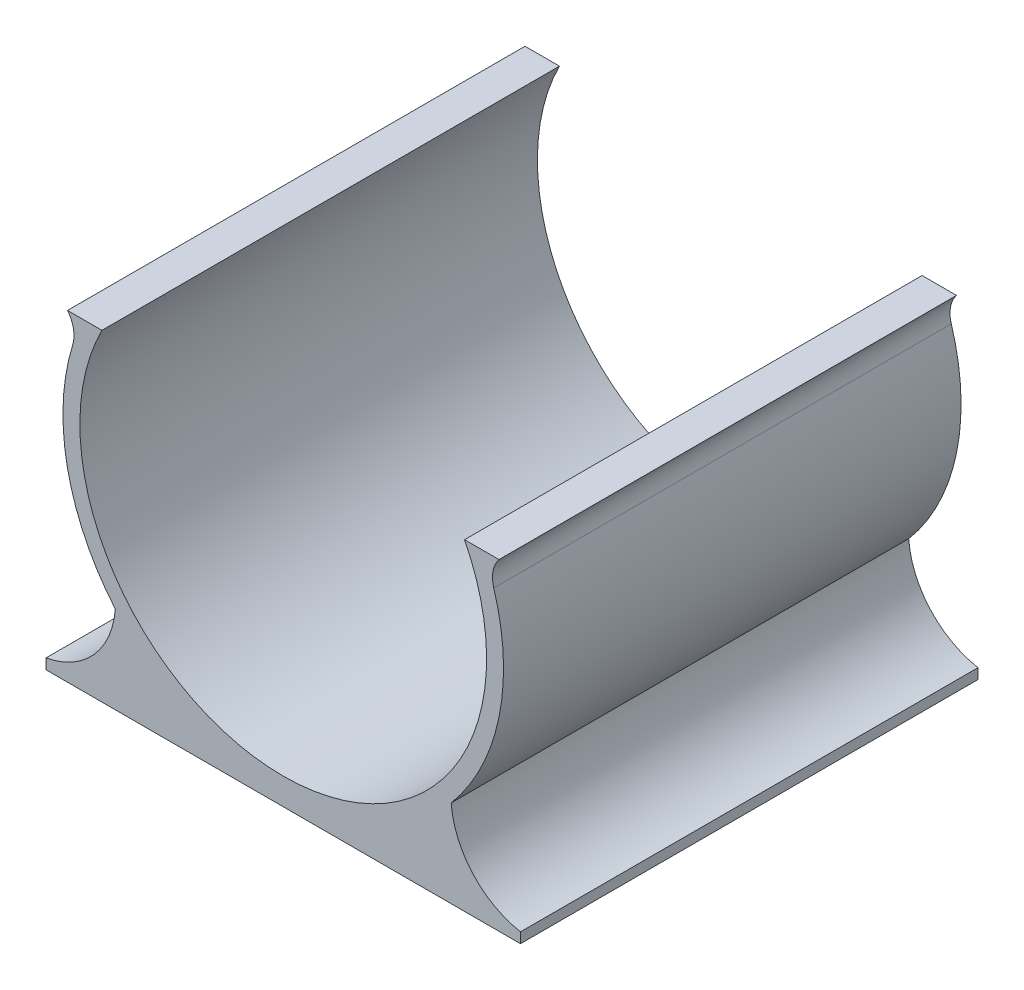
SolidWorks part; units mm, degrees
ref_plane "Front Plane" through (0, 0, 0) normal (0, 0, 1) x (1, 0, 0)
ref_plane "Top Plane" through (0, 0, 0) normal (0, 1, 0) x (1, 0, 0)
ref_plane "Right Plane" through (0, 0, 0) normal (1, 0, 0) x (0, 0, -1)
ref_plane "Plane1" through (0, -14, 0) normal (0, -1, 0) x (1, 0, 0)
sketch "Sketch1" plane through (0, -14, 0) normal (0, -1, 0) x (1, 0, 0)
  line L0 (-13, 0) -> (15, 0)
  line L1 (15, 0) -> (15, 27)
  line L2 (15, 27) -> (-13, 27)
  line L3 (-13, 27) -> (-13, 0)
  dimension "D1" = 28
  dimension "D2" = 27
extrude "Extrude1" add sketch "Sketch1" against normal blind 19
sketch "Sketch2" plane through (0, 0, 0) normal (0, 0, -1) x (-1, 0, 0)
  line L0 (-14.5994, 5.5776) -> (-15.8957, 5.5776)
  line L1 (-15.8957, 5.5776) -> (-15.8957, -13.4726)
  line L2 (-15, -14) -> (13, -14) construction
  line L3 (-1, -14) -> (-1, 7.3227) construction
  line L4 (12.5994, 5.5776) -> (13.8957, 5.5776)
  line L5 (13.8957, 5.5776) -> (13.8957, -13.4726)
  arc A0 (-10.9098, -8.8476) -> (-13.4237, 3.3942) centre (-1, -0.4336) cw
  arc A1 (-13.4237, 3.3942) -> (-14.5994, 5.5776) centre (-15.0872, 3.9067) ccw
  arc A2 (-15.8957, -13.4726) -> (-10.9098, -8.8476) centre (-15.8957, -8.4726) ccw
  arc A3 (11.4237, 3.3942) -> (12.5994, 5.5776) centre (13.0872, 3.9067) cw
  arc A4 (13.8957, -13.4726) -> (8.9098, -8.8476) centre (13.8957, -8.4726) cw
  arc A5 (8.9098, -8.8476) -> (11.4237, 3.3942) centre (-1, -0.4336) ccw
  circle A6 centre (-1, -0.4336) radius 12
  dimension "D1" = 1
  dimension "D2" = 24
extrude "Cut-Extrude1" cut sketch "Sketch2" against normal up to next
